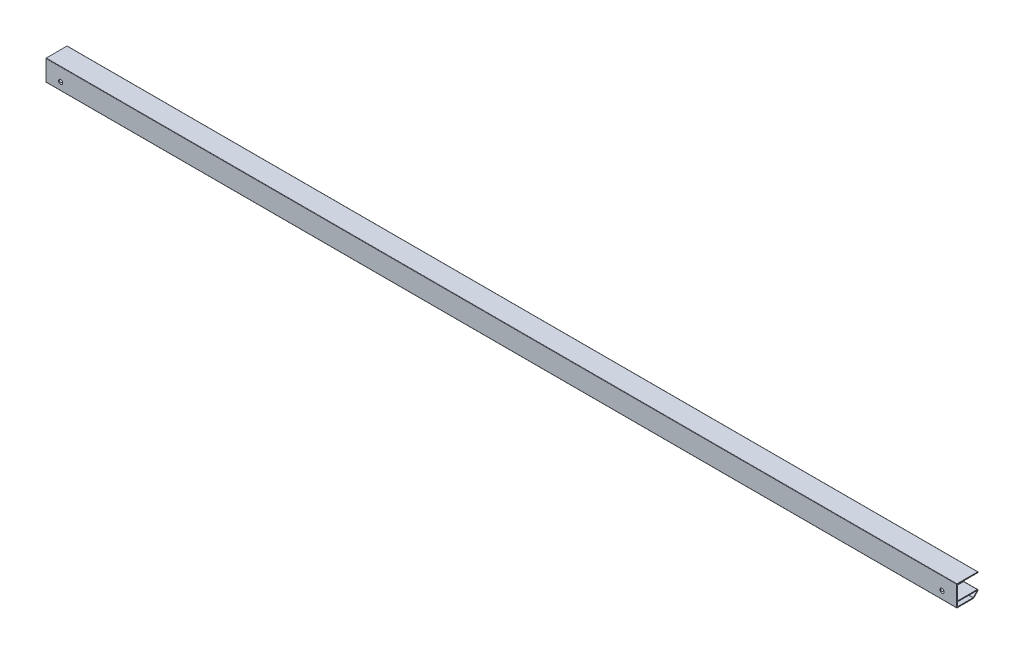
SolidWorks part; units mm, degrees
ref_plane "Plan de face" through (0, 0, 0) normal (0, 0, 1) x (1, 0, 0)
ref_plane "Plan de dessus" through (0, 0, 0) normal (0, 1, 0) x (1, 0, 0)
ref_plane "Plan de droite" through (0, 0, 0) normal (1, 0, 0) x (0, 0, -1)
sketch "Esquisse1" plane through (0, 0, 0) normal (1, 0, 0) x (0, 0, -1)
  line L0 (0, 24.6) -> (0, 0.4)
  line L1 (0.4, 25) -> (25, 25)
  line L2 (25.4, 24.6) -> (25.4, 24.4)
  line L3 (25, 24) -> (1.25, 24)
  line L4 (0.4, 0) -> (19.5858, 0)
  line L5 (20.2929, 0.2929) -> (25.1071, 5.1071)
  line L6 (1, 23.75) -> (1, 7.25)
  line L7 (1.25, 7) -> (24.4, 7)
  line L8 (25.4, 6) -> (25.4, 5.8142)
  line L9 (1, 5.75) -> (1, 1.25)
  line L10 (1.25, 1) -> (19.4201, 1)
  line L11 (1.25, 6) -> (23.8585, 6)
  line L12 (19.7029, 1.1172) -> (24.0715, 5.4857)
  arc A0 (0, 0.4) -> (0.4, 0) centre (0.4, 0.4) ccw
  arc A1 (0, 24.6) -> (0.4, 25) centre (0.4, 24.6) cw
  arc A2 (25, 25) -> (25.4, 24.6) centre (25, 24.6) cw
  arc A3 (25.4, 24.4) -> (25, 24) centre (25, 24.4) cw
  arc A4 (19.5858, 0) -> (20.2929, 0.2929) centre (19.5858, 1) ccw
  arc A5 (25.1071, 5.1071) -> (25.4, 5.8142) centre (24.4, 5.8142) ccw
  arc A6 (24.4, 7) -> (25.4, 6) centre (24.4, 6) cw
  arc A7 (1.25, 24) -> (1, 23.75) centre (1.25, 23.75) ccw
  arc A8 (1, 7.25) -> (1.25, 7) centre (1.25, 7.25) ccw
  arc A9 (1, 1.25) -> (1.25, 1) centre (1.25, 1.25) ccw
  arc A10 (1, 5.75) -> (1.25, 6) centre (1.25, 5.75) cw
  arc A11 (24.0715, 5.4857) -> (23.8585, 6) centre (23.8585, 5.6987) ccw
  arc A13 (19.4201, 1) -> (19.7029, 1.1172) centre (19.4201, 1.4) ccw
  point P22 (0, 0)
  point P25 (0, 25)
  point P28 (25.4, 25)
  point P31 (25.4, 24)
  point P34 (20, 0)
  point P39 (25.4, 7)
  point P42 (1, 24)
  point P45 (1, 7)
  dimension "D13" = 0.4
  dimension "D14" = 1
  dimension "D15" = 0.25
  dimension "D17" = 0.4
  dimension "D1" = 25
  dimension "D2" = 25.4
  dimension "D3" = 1
  dimension "D4" = 24.4
  dimension "D5" = 20
  dimension "D6" = 135
  dimension "D7" = 7
  dimension "D8" = 24.4
  dimension "D9" = 1
  dimension "D10" = 1
  dimension "D11" = 1
extrude "Boss.-Extru.1" add sketch "Esquisse1" along normal blind 1087
sketch "Esquisse2" plane through (0, 0, 0) normal (0, 0, 1) x (1, 0, 0)
  line L0 (1087, 25) -> (0, 25) construction
  line L1 (0, 24.6) -> (0, 0.4) construction
  line L2 (543.5, 24.6) -> (543.5, -33.2382) construction
  line L3 (1087, 24.6) -> (0, 24.6) construction
  circle A0 centre (17.5, 9.2) radius 2.5
  circle A1 centre (1069.5, 9.2) radius 2.5
  dimension "D1" = 5
  dimension "D2" = 15.8
  dimension "D3" = 17.5
extrude "Enlèv. mat.-Extru.1" cut sketch "Esquisse2" against normal through all
